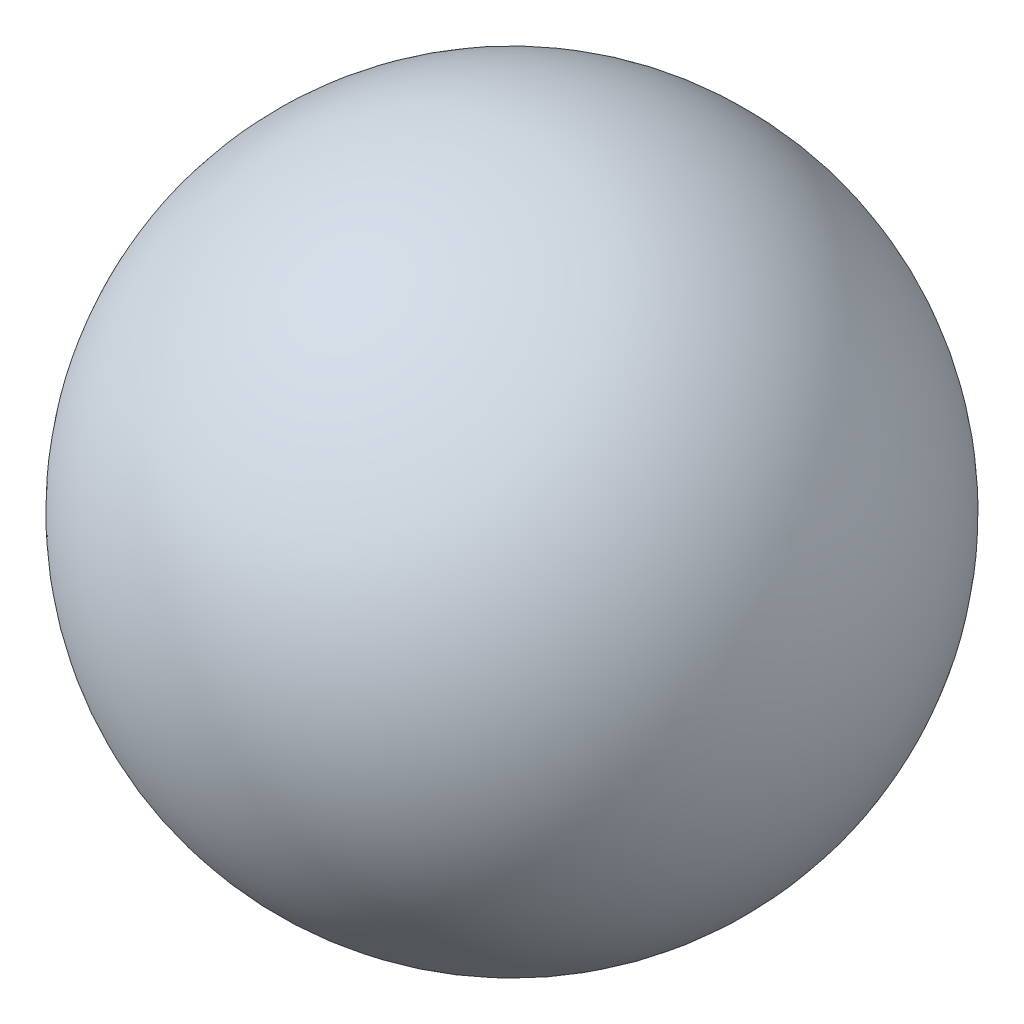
SolidWorks part; units mm, degrees
ref_plane "Plan1" through (0, 0, 0) normal (0, 0, 1) x (1, 0, 0)
ref_plane "Plan2" through (0, 0, 0) normal (0, 1, 0) x (1, 0, 0)
ref_plane "Plan3" through (0, 0, 0) normal (1, 0, 0) x (0, 0, -1)
sketch "Esquisse1" plane through (0, 0, 0) normal (0, 0, 1) x (1, 0, 0)
  line L0 (-2.25, 0) -> (2.25, 0)
  line L1 (-10, 0) -> (10, 0) construction
  arc A0 (-2.25, 0) -> (2.25, 0) centre (0, 0) ccw
  dimension "D1" = 4.5
revolve "Base-Révolution" add sketch "Esquisse1" angle 360 about L1
